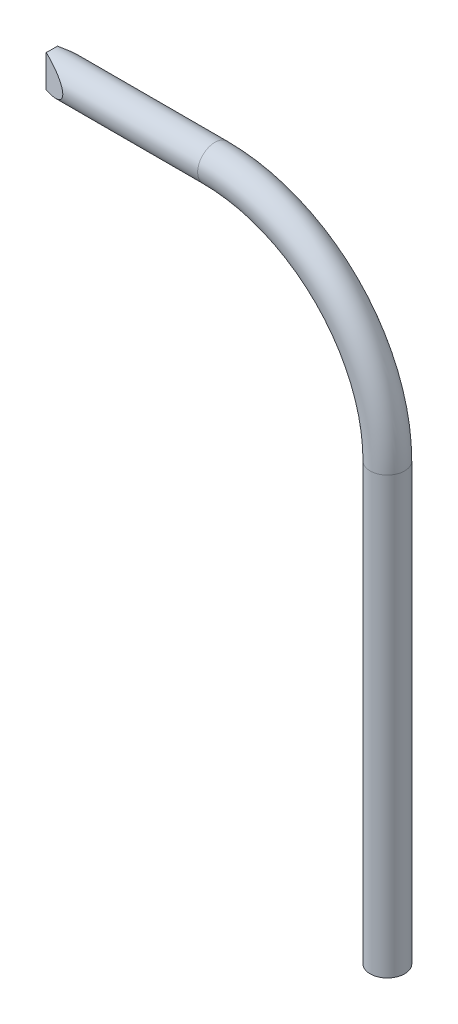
SolidWorks part; units mm, degrees
ref_plane "Plan de face" through (0, 0, 0) normal (0, 0, 1) x (1, 0, 0)
ref_plane "Plan de dessus" through (0, 0, 0) normal (0, 1, 0) x (1, 0, 0)
ref_plane "Plan de droite" through (0, 0, 0) normal (1, 0, 0) x (0, 0, -1)
sketch "Esquisse1" plane through (0, 0, 0) normal (0, 0, 1) x (1, 0, 0)
  line L0 (-317.3378, 1140) -> (-317.3378, 635)
  line L1 (-317.3378, 799) -> (-317.3378, 815) construction
  line L2 (-390.777, 665) -> (-307.7433, 665) construction
  line L3 (-517.3378, 1340) -> (-721.1164, 1340)
  arc A0 (-317.3378, 1140) -> (-517.3378, 1340) centre (-517.3378, 1140) ccw
  point P10 (-317.3378, 1340)
  dimension "D4" = 200
  dimension "D1" = 30
  dimension "D2" = 705
ref_plane "Plan1" through (-317.3378, 635, 0) normal (0, -1, 0) x (1, 0, 0)
sketch "Esquisse2" plane through (-317.3378, 635, 0) normal (0, -1, 0) x (1, 0, 0)
  circle A0 centre (0, 0) radius 20
  dimension "D1" = 40
sweep "Balayage1" add profiles "Esquisse2" path "Esquisse1"
sketch "Esquisse3" plane through (0, 0, 0) normal (0, 1, 0) x (1, 0, 0)
  line L0 (-722.0129, 0) -> (-621.2599, -41.7333)
  line L1 (-621.2599, -41.7333) -> (-809.9885, -25.6852)
  line L2 (-809.9885, -25.6852) -> (-705.4453, 137.0983)
  line L3 (-705.4453, 137.0983) -> (-597.4079, 51.6131)
  line L4 (-597.4079, 51.6131) -> (-722.0129, 0)
  line L5 (-722.0129, 0) -> (-589.5707, 0) construction
  dimension "D1" = 22.5
  dimension "D2" = 22.5
extrude "Enlèv. mat.-Extru.2" cut sketch "Esquisse3" along normal blind 1773
sketch "Esquisse5" plane through (0, 0, 0) normal (0, 1, 0) x (1, 0, 0)
  circle A0 centre (-722.0129, 0) radius 16.85
  dimension "D1" = 33.7
extrude "Enlèv. mat.-Extru.3" cut sketch "Esquisse5" along normal blind 1773
